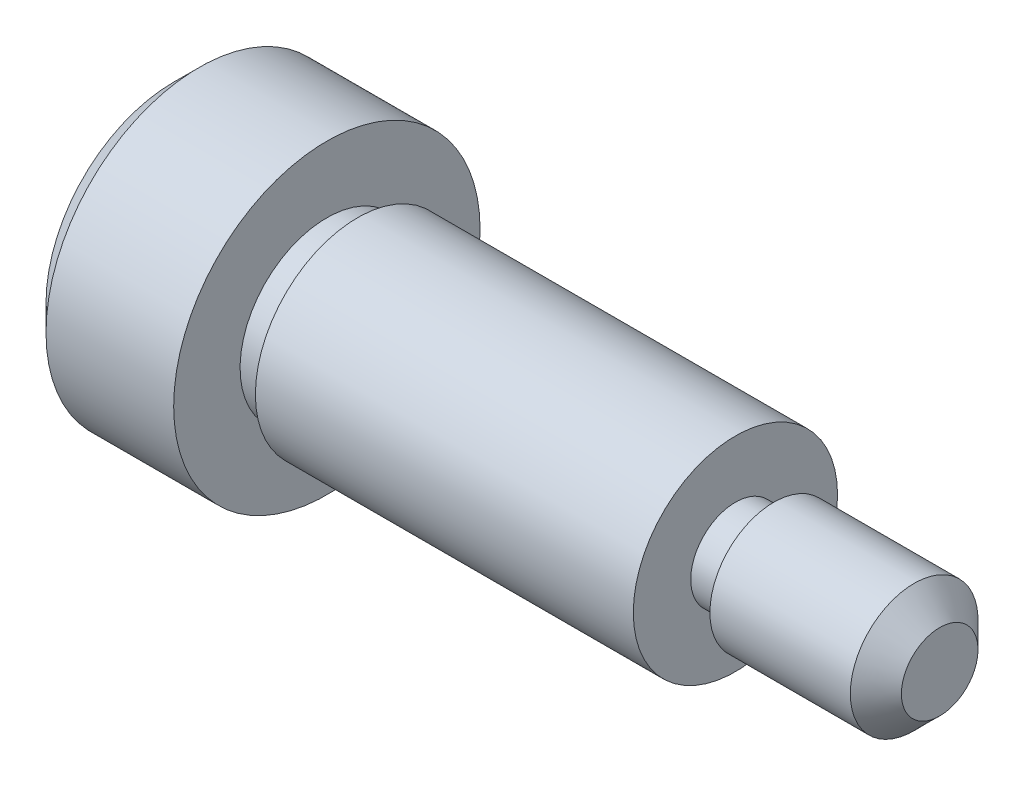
SolidWorks part; units mm, degrees
ref_plane "Front Plane" through (0, 0, 0) normal (0, 0, 1) x (1, 0, 0)
ref_plane "Top Plane" through (0, 0, 0) normal (0, 1, 0) x (1, 0, 0)
ref_plane "Right Plane" through (0, 0, 0) normal (1, 0, 0) x (0, 0, -1)
sketch "body sketch" plane through (0, 0, 0) normal (0, 0, 1) x (1, 0, 0)
  line L0 (-3, 0) -> (12, 0)
  line L1 (12, 0) -> (12, 1.25)
  line L2 (12, 1.25) -> (8, 1.25)
  line L3 (8, 1.25) -> (8, 2)
  line L4 (8, 2) -> (0, 2)
  line L5 (0, 2) -> (0, 3)
  line L6 (0, 3) -> (-3, 3)
  line L7 (-3, 3) -> (-3, 0)
  line L8 (0, 0) -> (21.8609, 0) construction
  dimension "head height" = 3
  dimension "shoulder length" = 8
  dimension "thread length" = 4
  dimension "thread dia" = 2.5
  dimension "shoulder dia" = 4
  dimension "head dia" = 6
revolve "body" add sketch "body sketch" angle 360 about L8
sketch "undercut sketch" plane through (0, 0, 0) normal (0, 0, 1) x (1, 0, 0)
  line L0 (8, 2) -> (0, 2) construction
  line L1 (0.6, 2) -> (0, 2)
  line L2 (0.6, 2) -> (0.6, 1.7)
  line L3 (0.6, 1.7) -> (0, 1.7)
  line L4 (0, 2) -> (0, 1.7)
  line L5 (0, -2) -> (0, 2) construction
  line L6 (12, 1.25) -> (8, 1.25) construction
  line L7 (8.75, 1.25) -> (8, 1.25)
  line L8 (8.75, 1.25) -> (8.75, 0.875)
  line L9 (8.75, 0.875) -> (8, 0.875)
  line L10 (8, 1.25) -> (8, 0.875)
  line L11 (8, -1.25) -> (8, 1.25) construction
  line L12 (0, 0) -> (8.75, 0) construction
  line L13 (0.3, 2) -> (0.6, 1.7) construction
  line L14 (0.6, 1.7) -> (1.0458, 1.4588) construction
  line L15 (8.375, 1.25) -> (8.75, 0.875) construction
  dimension "D1" = 45
  dimension "shoulderwidth" = 0.6
  dimension "D2" = 45
  dimension "thd width" = 0.75
revolve "undercut" cut sketch "undercut sketch" angle 360 about L12
sketch "hex socket sketch" plane through (-3, 0, 0) normal (-1, 0, 0) x (0, 0, 1)
  line L1 (0.5774, 1) -> (-0.5774, 1)
  line L2 (-0.5774, 1) -> (-1.1547, 0)
  line L3 (-1.1547, 0) -> (-0.5774, -1)
  line L4 (-0.5774, -1) -> (0.5774, -1)
  line L5 (0.5774, -1) -> (1.1547, 0)
  line L6 (1.1547, 0) -> (0.5774, 1)
  circle A0 centre (0, 0) radius 1 construction
  dimension "socket dia" = 2
extrude "hex socket" cut sketch "hex socket sketch" against normal blind 1.6
chamfer "Chamfer" distance 0.5 angle 45 2 edges at (-3, 0, 3) (12, 0, 1.25)
